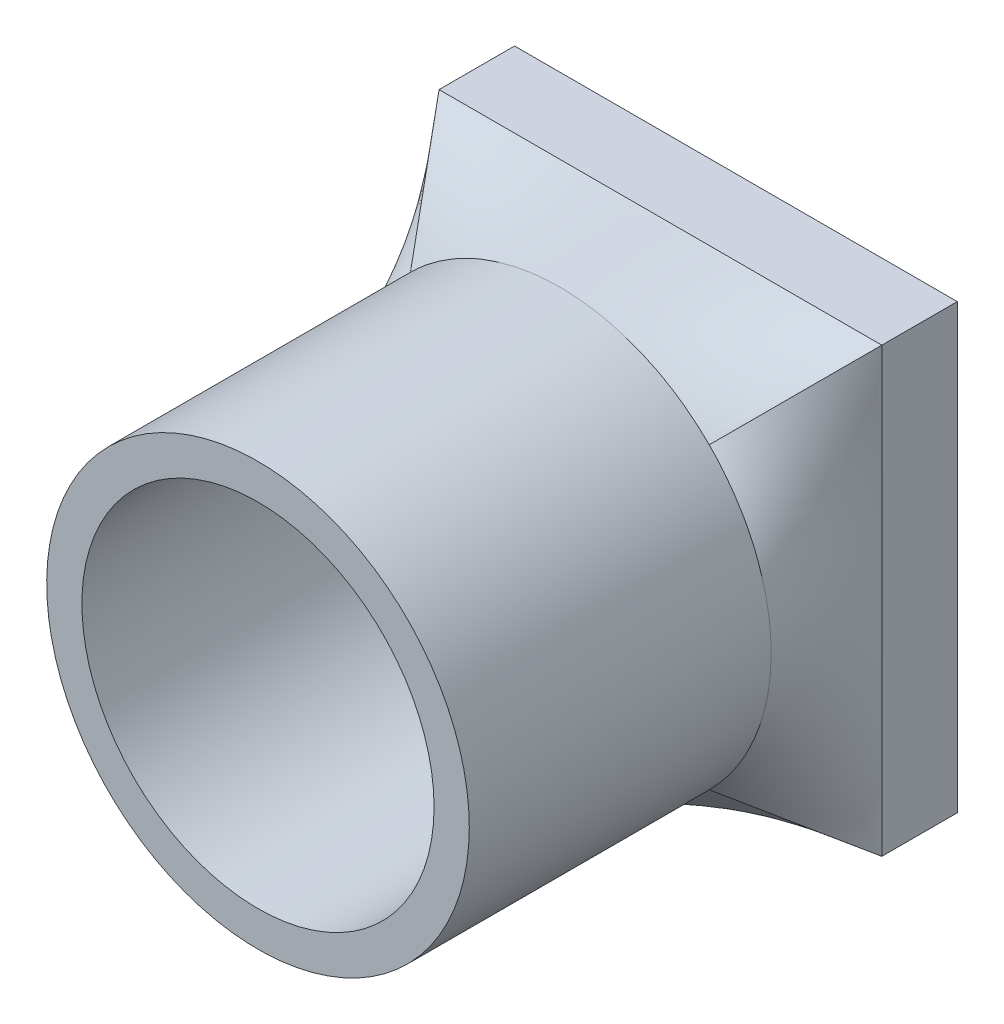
SolidWorks part; units mm, degrees
ref_plane "Front Plane" through (0, 0, 0) normal (0, 0, 1) x (1, 0, 0)
ref_plane "Top Plane" through (0, 0, 0) normal (0, 1, 0) x (1, 0, 0)
ref_plane "Right Plane" through (0, 0, 0) normal (1, 0, 0) x (0, 0, -1)
ref_plane "Plane1" through (0, 0, 175) normal (0, 0, 1) x (1, 0, 0)
sketch "Sketch1" plane through (0, 0, 175) normal (0, 0, 1) x (1, 0, 0)
  circle A0 centre (0, 0) radius 210
extrude "Boss-Extrude1" add sketch "Sketch1" along normal blind 300
sketch "Sketch8" plane through (0, 0, 0) normal (0, 0, 1) x (1, 0, 0)
  line L1 (-220, -220) -> (220, -220)
  line L2 (-220, -220) -> (-220, 220)
  line L3 (-220, 220) -> (220, 220)
  line L4 (220, -220) -> (220, 220)
  line L5 (-220, -220) -> (220, 220) construction
  line L6 (-220, 220) -> (220, -220) construction
  point P0 (0, 0)
  dimension "D1" = 440
extrude "Boss-Extrude2" add sketch "Sketch8" along normal blind 75
sketch "Sketch7" plane through (0, 0, 475) normal (0, 0, 1) x (1, 0, 0)
  circle A0 centre (0, 0) radius 175
extrude "Cut-Extrude1" cut sketch "Sketch7" against normal blind 250
loft "Loft1" add
equation "\"connector1_l\"= 250"
equation "\"connector1_d\"= 350"
equation "\"connector2_l\"= 220"
equation "\"connector2_d\"= 280"
equation "\"member1_d\"= 350"
equation "\"member2_d\"= 280"
equation "\"box_l\"= 150"
equation "\"D1@Sketch7\"=\"connector1_d\""
equation "\"D1@Cut-Extrude1\"=\"connector1_l\""
equation "\"end_l\" = 400"
equation "\"end_d\" = 420"
equation "\"p1_m2_l\" = 250"
equation "\"p1_m1_l\" = 200"
equation "\"D1@Boss-Extrude1\"=\"end_l\"-100"
equation "\"D1@Sketch1\"=\"end_d\""
equation "\"p2_m_l\" = 7500"
equation "\"p3_m_l\" = 4000"
equation "\"p3_offset\" = 400"
equation "\"end2_l\" = 300"
equation "\"end2_d\" = 350"
equation "\"p4_m_l\" = 3500"
equation "\"base_h\" = 75"
equation "\"D1@Plane1\"=\"base_h\"+100"
equation "\"D1@Boss-Extrude2\"=\"base_h\""
